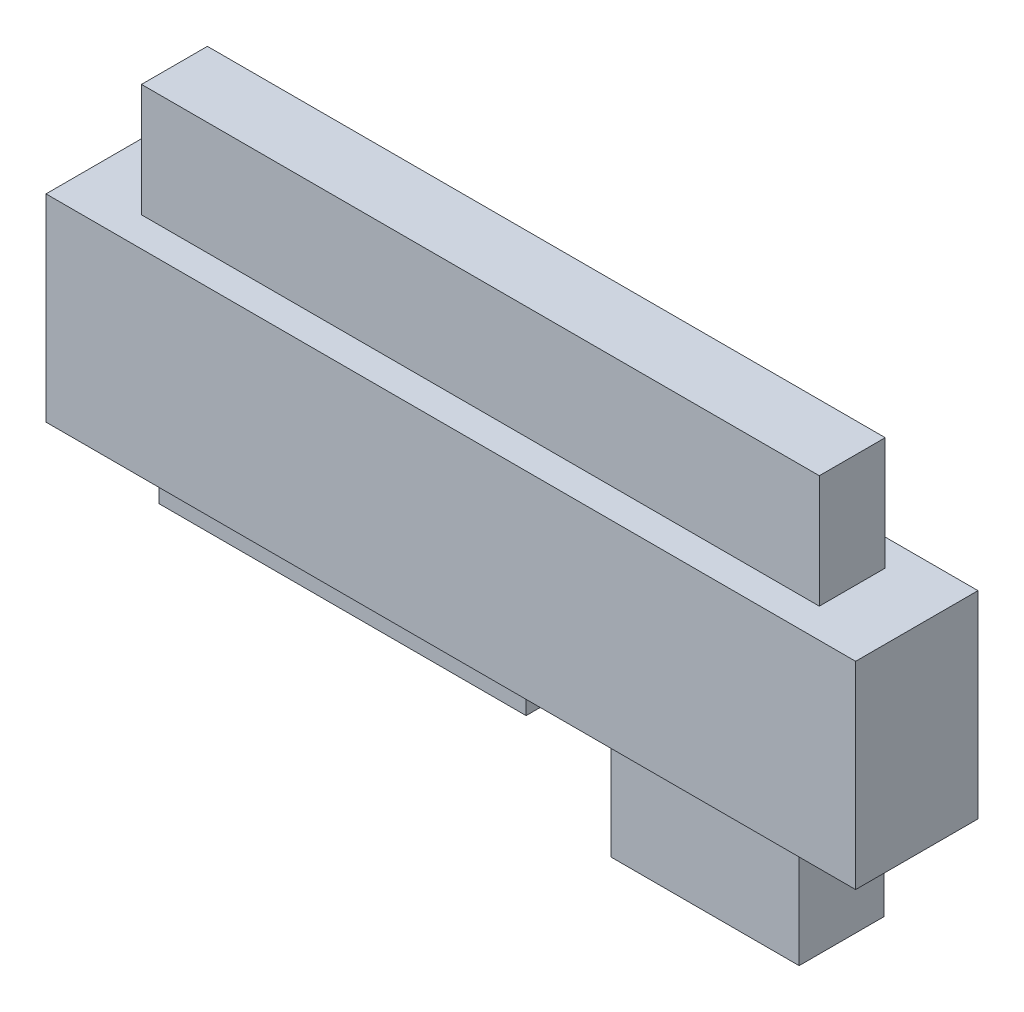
SolidWorks part; units mm, degrees
ref_plane "Front Plane" through (0, 0, 0) normal (0, 0, 1) x (1, 0, 0)
ref_plane "Top Plane" through (0, 0, 0) normal (0, 1, 0) x (1, 0, 0)
ref_plane "Right Plane" through (0, 0, 0) normal (1, 0, 0) x (0, 0, -1)
sketch "Sketch1" plane through (0, 0, 0) normal (0, 1, 0) x (1, 0, 0)
  line L1 (-21.5, -3.25) -> (21.5, -3.25)
  line L2 (-21.5, -3.25) -> (-21.5, 3.25)
  line L3 (-21.5, 3.25) -> (21.5, 3.25)
  line L4 (21.5, -3.25) -> (21.5, 3.25)
  line L5 (-21.5, -3.25) -> (21.5, 3.25) construction
  line L6 (-21.5, 3.25) -> (21.5, -3.25) construction
  point P0 (0, 0)
  dimension "D1" = 6.5
  dimension "D2" = 43
extrude "Boss-Extrude1" add sketch "Sketch1" along normal blind 10.5
sketch "Sketch2" plane through (0, 10.5, 0) normal (0, 1, 0) x (1, 0, 0)
  line L0 (0, 3.3942) -> (0, -3.25) construction
  line L2 (-21.5, -3.25) -> (21.5, -3.25) construction
  line L4 (-18, -1.6779) -> (18, -1.6779)
  line L5 (-18, -1.6779) -> (-18, 1.8221)
  line L6 (-18, 1.8221) -> (18, 1.8221)
  line L7 (18, -1.6779) -> (18, 1.8221)
  line L8 (-18, -1.6779) -> (18, 1.8221) construction
  line L9 (-18, 1.8221) -> (18, -1.6779) construction
  point P4 (0, 0.0721)
  dimension "D1" = 3.5
  dimension "D2" = 36
extrude "Boss-Extrude3" add sketch "Sketch2" along normal offset from surface (6 mm away) 16.5
sketch "Sketch3" plane through (0, 0, 0) normal (0, -1, 0) x (1, 0, 0)
  line L0 (21.5, 0) -> (-21.5, 0) construction
  line L1 (21.5, 3.25) -> (21.5, -3.25) construction
  line L2 (-21.5, -3.25) -> (-21.5, 3.25) construction
  line L4 (7.5, -2.25) -> (17.5, -2.25)
  line L5 (7.5, -2.25) -> (7.5, 2.25)
  line L6 (7.5, 2.25) -> (17.5, 2.25)
  line L7 (17.5, -2.25) -> (17.5, 2.25)
  line L8 (7.5, -2.25) -> (17.5, 2.25) construction
  line L9 (7.5, 2.25) -> (17.5, -2.25) construction
  point P6 (12.5, 0)
  dimension "D1" = 10
  dimension "D2" = 4.5
  dimension "D3" = 14
extrude "Boss-Extrude4" add sketch "Sketch3" along normal offset from surface (6 mm away) 16.5
sketch "Sketch4" plane through (0, 0, 0) normal (0, -1, 0) x (1, 0, 0)
  line L0 (-21.5, 0) -> (7.5, 0) construction
  line L1 (-21.5, -3.25) -> (-21.5, 3.25) construction
  line L2 (7.5, 2.25) -> (7.5, -2.25) construction
  line L4 (-16.75, -2) -> (2.75, -2)
  line L5 (-16.75, -2) -> (-16.75, 2)
  line L6 (-16.75, 2) -> (2.75, 2)
  line L7 (2.75, -2) -> (2.75, 2)
  line L8 (-16.75, -2) -> (2.75, 2) construction
  line L9 (-16.75, 2) -> (2.75, -2) construction
  point P6 (-7, 0)
  dimension "D1" = 4
  dimension "D2" = 19.5
extrude "Boss-Extrude5" add sketch "Sketch4" along normal offset from surface (2 mm away) 12.5
